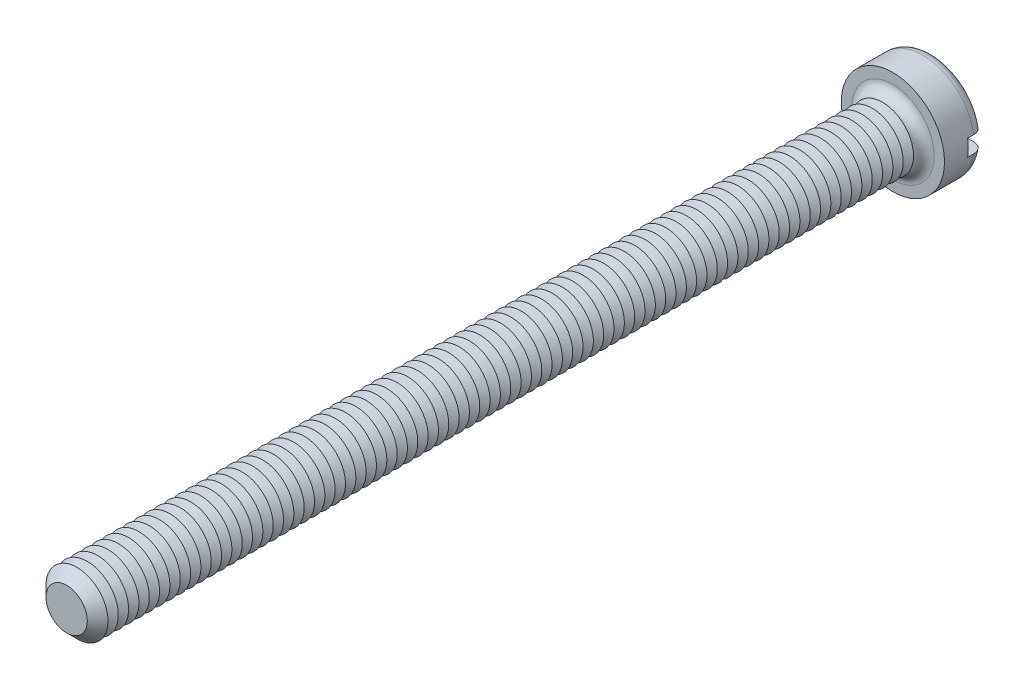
SolidWorks part; units mm, degrees
ref_plane "Front Plane" through (0, 0, 0) normal (0, 0, 1) x (1, 0, 0)
ref_plane "Top Plane" through (0, 0, 0) normal (0, 1, 0) x (1, 0, 0)
ref_plane "Right Plane" through (0, 0, 0) normal (1, 0, 0) x (0, 0, -1)
sketch "Sketch3" plane through (0, 0, 0) normal (0, 0, 1) x (1, 0, 0)
  circle A0 centre (0, 0) radius 5
  dimension "D1" = 10
extrude "Boss-Extrude2" add sketch "Sketch3" against normal blind 3.9
sketch "Sketch4" plane through (0, 0, 0) normal (0, 0, 1) x (1, 0, 0)
  circle A0 centre (0, 0) radius 3
  dimension "D1" = 6
extrude "Boss-Extrude3" add sketch "Sketch4" along normal blind 80
fillet "Fillet1" radius 1 2 edges at (5, 0, -3.9) (3, 0, 0)
chamfer "Chamfer1" distance 1 angle 45 1 edges at (3, 0, 80)
sketch "Sketch5" plane through (0, 0, 0) normal (1, 0, 0) x (0, 0, -1)
  line L0 (1.6944, 0) -> (-7.6738, 0) construction
sketch "Sketch6" plane through (0, 0, 0) normal (1, 0, 0) x (0, 0, -1)
  line L0 (-1, 3) -> (-1.5, 2.134)
  line L1 (-1.5, 2.134) -> (-2, 3)
  line L2 (-1, 3) -> (-79, 3) construction
  line L3 (-2, 3) -> (-1, 3)
  dimension "D1" = 1
revolve "Cut-Revolve1" cut sketch "Sketch6" angle 360 about L0
pattern_linear "LPattern1" count 78 spacing 1 along (0, 0, 1) of "Cut-Revolve1"
sketch "Sketch8" plane through (0, 0, -3.9) normal (0, 0, -1) x (-1, 0, 0)
  line L1 (5, -0.8) -> (-5, -0.8)
  line L2 (5, -0.8) -> (5, 0.8)
  line L3 (5, 0.8) -> (-5, 0.8)
  line L4 (-5, -0.8) -> (-5, 0.8)
  line L5 (5, -0.8) -> (-5, 0.8) construction
  line L6 (5, 0.8) -> (-5, -0.8) construction
  point P0 (0, 0)
  dimension "D1" = 10
  dimension "D2" = 1.6
extrude "Cut-Extrude1" cut sketch "Sketch8" against normal blind 1.6
